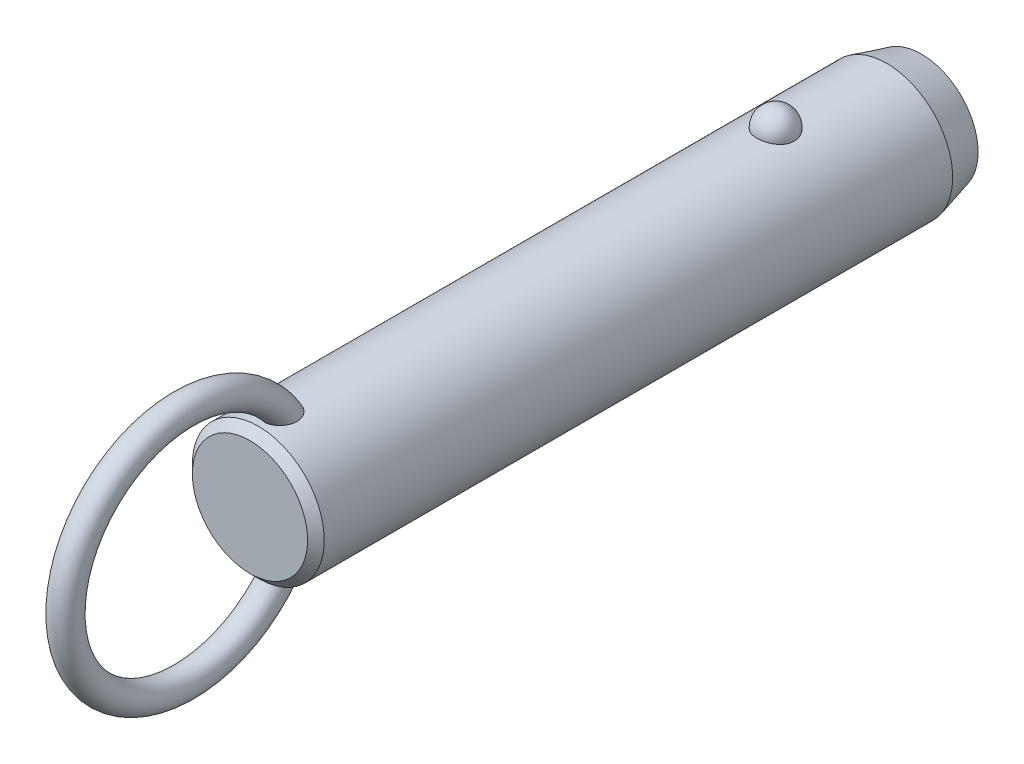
SolidWorks part; units mm, degrees
ref_plane "Front Plane" through (0, 0, 0) normal (0, 0, 1) x (1, 0, 0)
ref_plane "Top Plane" through (0, 0, 0) normal (0, 1, 0) x (1, 0, 0)
ref_plane "Right Plane" through (0, 0, 0) normal (1, 0, 0) x (0, 0, -1)
sketch "Sketch2" plane through (0, 0, 0) normal (0, 0, 1) x (1, 0, 0)
  circle A0 centre (0, 0) radius 9.5
  point P3 (0, 9.5)
  dimension "D1" = 19
extrude "Boss-Extrude1" add sketch "Sketch2" along normal blind 63.5
sketch "Sketch3" plane through (0, 0, 0) normal (0, 0, -1) x (-1, 0, 0)
  circle A0 centre (0, 0) radius 9.5
  dimension "D1" = 19
extrude "Boss-Extrude2" add sketch "Sketch3" along normal blind 23.7
chamfer "Chamfer1" distance 5 angle 15 1 edges at (-9.5, 0, -23.7)
sketch "Sketch12" plane through (0, 0, 0) normal (1, 0, 0) x (0, 0, -1)
  line L0 (-63.5, 9.5) -> (-63.5, -9.5) construction
  point P0 (-63.5, 0)
sketch "Sketch13" plane through (0, 0, 0) normal (1, 0, 0) x (0, 0, -1)
  circle A0 centre (-82.55, 0) radius 19.05
  point P2 (-63.5, 0)
  dimension "D1" = 38.1
sketch "Sketch14" plane through (0, 0, 0) normal (0, 1, 0) x (1, 0, 0)
  circle A0 centre (0, -65.5) radius 2
  point P2 (0, -63.5)
  dimension "D1" = 4
sweep "Sweep1" add profiles "Sketch14" path "Sketch13"
sketch "Sketch15" plane through (0, 0, 63.5) normal (0, 0, 1) x (1, 0, 0)
  circle A0 centre (0, 0) radius 9.5
  dimension "D1" = 19
extrude "Boss-Extrude3" add sketch "Sketch15" along normal blind 9.52
chamfer "Chamfer2" distance 1.2 angle 45 1 edges at (9.5, 0, 73.02)
sketch "Sketch18" plane through (0, 0, 0) normal (1, 0, 0) x (0, 0, -1)
  line L0 (18.7, 9.5) -> (-66.0378, 9.5) construction
  line L1 (2.7, 12.2) -> (2.7, 6.8)
  line L2 (-66.0378, -9.5) -> (18.7, -9.5) construction
  arc A0 (2.7, 12.2) -> (2.7, 6.8) centre (2.7, 9.5) ccw
  point P4 (0, 9.5)
  dimension "D1" = 21.7
revolve "Revolve1" add sketch "Sketch18" angle 360 about L1
